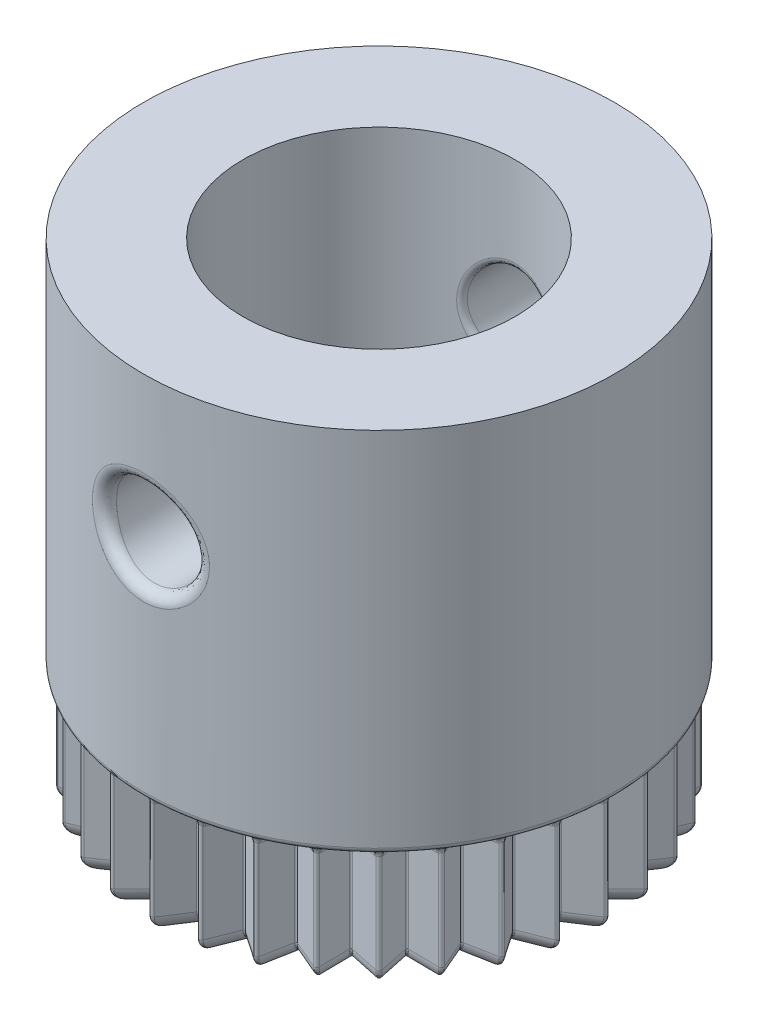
SolidWorks part; units mm, degrees
ref_plane "XY - Vorne" through (0, 0, 0) normal (0, 0, 1) x (1, 0, 0)
ref_plane "XZ - Oben" through (0, 0, 0) normal (0, 1, 0) x (1, 0, 0)
ref_plane "YZ - Rechts" through (0, 0, 0) normal (1, 0, 0) x (0, 0, -1)
sketch "Skizze1" plane through (0, 0, 0) normal (0, 1, 0) x (1, 0, 0)
  circle A0 centre (0, 0) radius 8.45
  dimension "D1" = 16.9
extrude "Aufsatz-Linear austragen1" add sketch "Skizze1" along normal blind 4.5
sketch "Skizze2" plane through (0, 4.5, 0) normal (0, 1, 0) x (1, 0, 0)
  line L0 (0, 0) -> (0, 8.45) construction
  line L1 (-0.0754, 8.3341) -> (-0.7229, 7.3395)
  line L2 (0.0754, 8.3341) -> (0.7229, 7.3395)
  line L4 (0.7229, 7.3395) -> (0, 0) construction
  line L66 (1.5519, 8.1887) -> (0.7229, 7.3395)
  line L67 (1.6999, 8.1593) -> (2.1408, 7.0574)
  line L68 (3.1196, 7.7286) -> (2.1408, 7.0574)
  line L69 (3.259, 7.6709) -> (3.4766, 6.5042)
  line L70 (4.5675, 6.9715) -> (3.4766, 6.5042)
  line L71 (4.6929, 6.8877) -> (4.6787, 5.701)
  line L72 (5.8398, 5.9465) -> (4.6787, 5.701)
  line L73 (5.9465, 5.8398) -> (5.701, 4.6787)
  line L74 (6.8877, 4.6929) -> (5.701, 4.6787)
  line L75 (6.9715, 4.5675) -> (6.5042, 3.4766)
  line L76 (7.6709, 3.259) -> (6.5042, 3.4766)
  line L77 (7.7286, 3.1196) -> (7.0574, 2.1408)
  line L78 (8.1593, 1.6999) -> (7.0574, 2.1408)
  line L79 (8.1887, 1.5519) -> (7.3395, 0.7229)
  line L80 (8.3341, 0.0754) -> (7.3395, 0.7229)
  line L81 (8.3341, -0.0754) -> (7.3395, -0.7229)
  line L82 (8.1887, -1.5519) -> (7.3395, -0.7229)
  line L83 (8.1593, -1.6999) -> (7.0574, -2.1408)
  line L84 (7.7286, -3.1196) -> (7.0574, -2.1408)
  line L85 (7.6709, -3.259) -> (6.5042, -3.4766)
  line L86 (6.9715, -4.5675) -> (6.5042, -3.4766)
  line L87 (6.8877, -4.6929) -> (5.701, -4.6787)
  line L88 (5.9465, -5.8398) -> (5.701, -4.6787)
  line L89 (5.8398, -5.9465) -> (4.6787, -5.701)
  line L90 (4.6929, -6.8877) -> (4.6787, -5.701)
  line L91 (4.5675, -6.9715) -> (3.4766, -6.5042)
  line L92 (3.259, -7.6709) -> (3.4766, -6.5042)
  line L93 (3.1196, -7.7286) -> (2.1408, -7.0574)
  line L94 (1.6999, -8.1593) -> (2.1408, -7.0574)
  line L95 (1.5519, -8.1887) -> (0.7229, -7.3395)
  line L96 (0.0754, -8.3341) -> (0.7229, -7.3395)
  line L97 (-0.0754, -8.3341) -> (-0.7229, -7.3395)
  line L98 (-1.5519, -8.1887) -> (-0.7229, -7.3395)
  line L99 (-1.6999, -8.1593) -> (-2.1408, -7.0574)
  line L100 (-3.1196, -7.7286) -> (-2.1408, -7.0574)
  line L101 (-3.259, -7.6709) -> (-3.4766, -6.5042)
  line L102 (-4.5675, -6.9715) -> (-3.4766, -6.5042)
  line L103 (-4.6929, -6.8877) -> (-4.6787, -5.701)
  line L104 (-5.8398, -5.9465) -> (-4.6787, -5.701)
  line L105 (-5.9465, -5.8398) -> (-5.701, -4.6787)
  line L106 (-6.8877, -4.6929) -> (-5.701, -4.6787)
  line L107 (-6.9715, -4.5675) -> (-6.5042, -3.4766)
  line L108 (-7.6709, -3.259) -> (-6.5042, -3.4766)
  line L109 (-7.7286, -3.1196) -> (-7.0574, -2.1408)
  line L110 (-8.1593, -1.6999) -> (-7.0574, -2.1408)
  line L111 (-8.1887, -1.5519) -> (-7.3395, -0.7229)
  line L112 (-8.3341, -0.0754) -> (-7.3395, -0.7229)
  line L113 (-8.3341, 0.0754) -> (-7.3395, 0.7229)
  line L114 (-8.1887, 1.5519) -> (-7.3395, 0.7229)
  line L115 (-8.1593, 1.6999) -> (-7.0574, 2.1408)
  line L116 (-7.7286, 3.1196) -> (-7.0574, 2.1408)
  line L117 (-7.6709, 3.259) -> (-6.5042, 3.4766)
  line L118 (-6.9715, 4.5675) -> (-6.5042, 3.4766)
  line L119 (-6.8877, 4.6929) -> (-5.701, 4.6787)
  line L120 (-5.9465, 5.8398) -> (-5.701, 4.6787)
  line L121 (-5.8398, 5.9465) -> (-4.6787, 5.701)
  line L122 (-4.6929, 6.8877) -> (-4.6787, 5.701)
  line L123 (-4.5675, 6.9715) -> (-3.4766, 6.5042)
  line L124 (-3.259, 7.6709) -> (-3.4766, 6.5042)
  line L125 (-3.1196, 7.7286) -> (-2.1408, 7.0574)
  line L126 (-1.6999, 8.1593) -> (-2.1408, 7.0574)
  line L127 (-1.5519, 8.1887) -> (-0.7229, 7.3395)
  circle A0 centre (0, 0) radius 7.375 construction
  circle A1 centre (0, 0) radius 8.45 construction
  arc A2 (0.0754, 8.3341) -> (-0.0754, 8.3341) centre (0, 8.285) ccw
  arc A3 (1.6999, 8.1593) -> (1.5519, 8.1887) centre (1.6163, 8.1258) ccw
  arc A4 (3.259, 7.6709) -> (3.1196, 7.7286) centre (3.1705, 7.6544) ccw
  arc A5 (4.6929, 6.8877) -> (4.5675, 6.9715) centre (4.6029, 6.8887) ccw
  arc A6 (5.9465, 5.8398) -> (5.8398, 5.9465) centre (5.8584, 5.8584) ccw
  arc A7 (6.9715, 4.5675) -> (6.8877, 4.6929) centre (6.8887, 4.6029) ccw
  arc A8 (7.7286, 3.1196) -> (7.6709, 3.259) centre (7.6544, 3.1705) ccw
  arc A9 (8.1887, 1.5519) -> (8.1593, 1.6999) centre (8.1258, 1.6163) ccw
  arc A10 (8.3341, -0.0754) -> (8.3341, 0.0754) centre (8.285, 0) ccw
  arc A11 (8.1593, -1.6999) -> (8.1887, -1.5519) centre (8.1258, -1.6163) ccw
  arc A12 (7.6709, -3.259) -> (7.7286, -3.1196) centre (7.6544, -3.1705) ccw
  arc A13 (6.8877, -4.6929) -> (6.9715, -4.5675) centre (6.8887, -4.6029) ccw
  arc A14 (5.8398, -5.9465) -> (5.9465, -5.8398) centre (5.8584, -5.8584) ccw
  arc A15 (4.5675, -6.9715) -> (4.6929, -6.8877) centre (4.6029, -6.8887) ccw
  arc A16 (3.1196, -7.7286) -> (3.259, -7.6709) centre (3.1705, -7.6544) ccw
  arc A17 (1.5519, -8.1887) -> (1.6999, -8.1593) centre (1.6163, -8.1258) ccw
  arc A18 (-0.0754, -8.3341) -> (0.0754, -8.3341) centre (0, -8.285) ccw
  arc A19 (-1.6999, -8.1593) -> (-1.5519, -8.1887) centre (-1.6163, -8.1258) ccw
  arc A20 (-3.259, -7.6709) -> (-3.1196, -7.7286) centre (-3.1705, -7.6544) ccw
  arc A21 (-4.6929, -6.8877) -> (-4.5675, -6.9715) centre (-4.6029, -6.8887) ccw
  arc A22 (-5.9465, -5.8398) -> (-5.8398, -5.9465) centre (-5.8584, -5.8584) ccw
  arc A23 (-6.9715, -4.5675) -> (-6.8877, -4.6929) centre (-6.8887, -4.6029) ccw
  arc A24 (-7.7286, -3.1196) -> (-7.6709, -3.259) centre (-7.6544, -3.1705) ccw
  arc A25 (-8.1887, -1.5519) -> (-8.1593, -1.6999) centre (-8.1258, -1.6163) ccw
  arc A26 (-8.3341, 0.0754) -> (-8.3341, -0.0754) centre (-8.285, 0) ccw
  arc A27 (-8.1593, 1.6999) -> (-8.1887, 1.5519) centre (-8.1258, 1.6163) ccw
  arc A28 (-7.6709, 3.259) -> (-7.7286, 3.1196) centre (-7.6544, 3.1705) ccw
  arc A29 (-6.8877, 4.6929) -> (-6.9715, 4.5675) centre (-6.8887, 4.6029) ccw
  arc A30 (-5.8398, 5.9465) -> (-5.9465, 5.8398) centre (-5.8584, 5.8584) ccw
  arc A31 (-4.5675, 6.9715) -> (-4.6929, 6.8877) centre (-4.6029, 6.8887) ccw
  arc A32 (-3.1196, 7.7286) -> (-3.259, 7.6709) centre (-3.1705, 7.6544) ccw
  arc A33 (-1.5519, 8.1887) -> (-1.6999, 8.1593) centre (-1.6163, 8.1258) ccw
  point P104 (0, 0)
  point P169 (0, 0)
  dimension "D1" = 14.75
  dimension "D4" = 0.09
  dimension "D2" = 5.625
  dimension "D3" = 32
extrude "Schnitt-Linear austragen2" cut sketch "Skizze2" against normal through all flip side to cut
sketch "Skizze3" plane through (0, 4.5, 0) normal (0, 1, 0) x (1, 0, 0)
  circle A0 centre (0, 0) radius 8.65
  dimension "D1" = 17.3
extrude "Aufsatz-Linear austragen2" add sketch "Skizze3" along normal blind 13.5
sketch "Skizze4" plane through (0, 18, 0) normal (0, 1, 0) x (1, 0, 0)
  circle A0 centre (0, 0) radius 5
  circle A1 centre (0, 0) radius 8.65 construction
  dimension "D1" = 10
extrude "Schnitt-Linear austragen3" cut sketch "Skizze4" against normal blind 15
hole_wizard "Ø3.3 (3.3) Durchmesser Bohrung1" positions "3D-Skizze1" profile "Skizze5" hole size "Ø3.3" standard "DIN"
sketch3d "3D-Skizze1"
  line L0 (0, 12.8, 8.65) -> (0, 18, 8.65) construction
  line L2 (0, 18, 8.65) -> (0, 18, 0) construction
  line L3 (0, 18, 0) -> (0, 4.5, 0) construction
  line L4 (0, 3, 0) -> (0, 18, 0) construction
  circle A0 centre (0, 18, 0) radius 8.65 construction
  point P0 (0, 12.8, 8.65)
  point P7 (0, 26.65, 0)
  dimension "D1" = 9.8
sketch "Skizze5" plane through (0, 12.8, 8.65) normal (1, 0, 0) x (0, -1, 0)
  line L0 (0, 0) -> (0, 17.3)
  line L1 (0, 17.3) -> (1.65, 17.3)
  line L2 (1.65, 17.3) -> (1.65, 0)
  line L5 (1.65, 0) -> (0, 0)
  line L11 (0, -6.35) -> (0, 107.95) construction
  dimension "Bohrerdurchmesser" = 3.3
  dimension "Bohrungstiefe" = 17.3
fillet "Verrundung1" radius 0.6 96 edges at (1.9204, 0, -7.6084) (1.6339, 0, -8.2141) (1.1374, 0, -7.7641) (0.3992, 0, -7.8368) (0, 0, -8.375) (-0.3992, 0, -7.8368) (-1.1374, 0, -7.7641) (-1.6339, 0, -8.2141) (-1.9204, 0, -7.6084) (-2.6302, 0, -7.393) (-3.205, 0, -7.7375) (-3.3678, 0, -7.0875) (-4.022, 0, -6.7378) (-4.6529, 0, -6.9636) (-4.6858, 0, -6.2943) (-5.2592, 0, -5.8237) (-5.922, 0, -5.922) (-5.8237, 0, -5.2592) (-6.2943, 0, -4.6858) (-6.9636, 0, -4.6529) (-6.7378, 0, -4.022) (-7.0875, 0, -3.3678) (-7.7375, 0, -3.205) (-7.393, 0, -2.6302) (-7.6084, 0, -1.9204) (-8.2141, 0, -1.6339) (-7.7641, 0, -1.1374) (-7.8368, 0, -0.3992) (-8.375, 0, 0) (-7.8368, 0, 0.3992) (-7.7641, 0, 1.1374) (-8.2141, 0, 1.6339) (-7.6084, 0, 1.9204) (-7.393, 0, 2.6302) (-7.7375, 0, 3.205) (-7.0875, 0, 3.3678) (-6.7378, 0, 4.022) (-6.9636, 0, 4.6529) (-6.2943, 0, 4.6858) (-5.8237, 0, 5.2592) (-5.922, 0, 5.922) (-5.2592, 0, 5.8237) (-4.6858, 0, 6.2943) (-4.6529, 0, 6.9636) (-4.022, 0, 6.7378) (-3.3678, 0, 7.0875) (-3.205, 0, 7.7375) (-2.6302, 0, 7.393) (-1.9204, 0, 7.6084) (-1.6339, 0, 8.2141) (-1.1374, 0, 7.7641) (-0.3992, 0, 7.8368) (0, 0, 8.375) (0.3992, 0, 7.8368) (1.1374, 0, 7.7641) (1.6339, 0, 8.2141) (1.9204, 0, 7.6084) (2.6302, 0, 7.393) (3.205, 0, 7.7375) (3.3678, 0, 7.0875) (4.022, 0, 6.7378) (4.6529, 0, 6.9636) (4.6858, 0, 6.2943) (5.2592, 0, 5.8237) (5.922, 0, 5.922) (5.8237, 0, 5.2592) (6.2943, 0, 4.6858) (6.9636, 0, 4.6529) (6.7378, 0, 4.022) (7.0875, 0, 3.3678) (7.7375, 0, 3.205) (7.393, 0, 2.6302) (7.6084, 0, 1.9204) (8.2141, 0, 1.6339) (7.7641, 0, 1.1374) (7.8368, 0, 0.3992) (8.375, 0, 0) (7.8368, 0, -0.3992) (7.7641, 0, -1.1374) (8.2141, 0, -1.6339) (7.6084, 0, -1.9204) (7.393, 0, -2.6302) (7.7375, 0, -3.205) (7.0875, 0, -3.3678) (6.7378, 0, -4.022) (6.9636, 0, -4.6529) (6.2943, 0, -4.6858) (5.8237, 0, -5.2592) (5.922, 0, -5.922) (5.2592, 0, -5.8237) (4.6858, 0, -6.2943) (4.6529, 0, -6.9636) (4.022, 0, -6.7378) (3.3678, 0, -7.0875) (3.205, 0, -7.7375) (2.6302, 0, -7.393)
fillet "Verrundung2" radius 0.2 1 edges at (0, 4.5, 8.65)
fillet "Verrundung3" radius 0.05 64 edges at (-4.5003, 0.1757, 5.4836) (-3.344, 0.1757, 6.2562) (-2.0592, 0.1757, 6.7884) (-0.6953, 0.1757, 7.0597) (0.6953, 0.1757, 7.0597) (2.0592, 0.1757, 6.7884) (3.344, 0.1757, 6.2562) (4.5003, 0.1757, 5.4836) (5.4836, 0.1757, 4.5003) (6.2562, 0.1757, 3.344) (6.7884, 0.1757, 2.0592) (7.0597, 0.1757, 0.6953) (7.0597, 0.1757, -0.6953) (6.7884, 0.1757, -2.0592) (6.2562, 0.1757, -3.344) (5.4836, 0.1757, -4.5003) (4.5003, 0.1757, -5.4836) (3.344, 0.1757, -6.2562) (2.0592, 0.1757, -6.7884) (0.6953, 0.1757, -7.0597) (-0.6953, 0.1757, -7.0597) (-2.0592, 0.1757, -6.7884) (-3.344, 0.1757, -6.2562) (-4.5003, 0.1757, -5.4836) (-5.4836, 0.1757, -4.5003) (-6.2562, 0.1757, -3.344) (-6.7884, 0.1757, -2.0592) (-7.0597, 0.1757, -0.6953) (-5.4836, 0.1757, 4.5003) (-6.2562, 0.1757, 3.344) (-6.7884, 0.1757, 2.0592) (-7.0597, 0.1757, 0.6953) (-4.6787, 2.55, 5.701) (-3.4766, 2.55, 6.5042) (-2.1408, 2.55, 7.0574) (-0.7229, 2.55, 7.3395) (0.7229, 2.55, 7.3395) (2.1408, 2.55, 7.0574) (3.4766, 2.55, 6.5042) (4.6787, 2.55, 5.701) (5.701, 2.55, 4.6787) (6.5042, 2.55, 3.4766) (7.0574, 2.55, 2.1408) (7.3395, 2.55, 0.7229) (7.3395, 2.55, -0.7229) (7.0574, 2.55, -2.1408) (6.5042, 2.55, -3.4766) (5.701, 2.55, -4.6787) (4.6787, 2.55, -5.701) (3.4766, 2.55, -6.5042) (2.1408, 2.55, -7.0574) (0.7229, 2.55, -7.3395) (-0.7229, 2.55, -7.3395) (-2.1408, 2.55, -7.0574) (-3.4766, 2.55, -6.5042) (-4.6787, 2.55, -5.701) (-5.701, 2.55, -4.6787) (-6.5042, 2.55, -3.4766) (-7.0574, 2.55, -2.1408) (-7.3395, 2.55, -0.7229) (-5.701, 2.55, 4.6787) (-6.5042, 2.55, 3.4766) (-7.0574, 2.55, 2.1408) (-7.3395, 2.55, 0.7229)
fillet "Verrundung4" radius 0.3 115 edges at (-5.922, 4.5, 5.922) (-5.8302, 4.5, 5.2898) (-5.7241, 4.5, 4.6977) (-6.3255, 4.5, 4.6862) (-6.9636, 4.5, 4.6529) (-6.7501, 4.5, 4.0507) (-6.5306, 4.5, 3.4907) (-7.1182, 4.5, 3.3621) (-7.4107, 4.5, 2.656) (-7.0861, 4.5, 2.1496) (-7.6373, 4.5, 1.9088) (-8.2141, 4.5, 1.6339) (-7.7864, 4.5, 1.1592) (-7.3693, 4.5, 0.7258) (-7.863, 4.5, 0.3821) (-8.375, 4.5, 0) (-7.863, 4.5, -0.3821) (-7.3693, 4.5, -0.7258) (-7.7864, 4.5, -1.1592) (-8.2141, 4.5, -1.6339) (-7.6373, 4.5, -1.9088) (-7.0861, 4.5, -2.1496) (-7.4107, 4.5, -2.656) (-7.7375, 4.5, -3.205) (-7.1182, 4.5, -3.3621) (-6.5306, 4.5, -3.4907) (-6.7501, 4.5, -4.0507) (-6.9636, 4.5, -4.6529) (-6.3255, 4.5, -4.6862) (-5.7241, 4.5, -4.6977) (-5.8302, 4.5, -5.2898) (-5.922, 4.5, -5.922) (-5.2898, 4.5, -5.8302) (-4.6977, 4.5, -5.7241) (-4.6529, 4.5, -6.9636) (-4.0507, 4.5, -6.7501) (-3.4907, 4.5, -6.5306) (-3.3621, 4.5, -7.1182) (-2.656, 4.5, -7.4107) (-2.1496, 4.5, -7.0861) (-1.9088, 4.5, -7.6373) (-1.6339, 4.5, -8.2141) (-1.1592, 4.5, -7.7864) (-0.7258, 4.5, -7.3693) (-0.3821, 4.5, -7.863) (0.3821, 4.5, -7.863) (0.7258, 4.5, -7.3693) (1.1592, 4.5, -7.7864) (1.6339, 4.5, -8.2141) (1.9088, 4.5, -7.6373) (2.656, 4.5, -7.4107) (3.205, 4.5, -7.7375) (3.3621, 4.5, -7.1182) (3.4907, 4.5, -6.5306) (4.0507, 4.5, -6.7501) (4.6862, 4.5, -6.3255) (4.6977, 4.5, -5.7241) (5.2898, 4.5, -5.8302) (5.922, 4.5, -5.922) (5.8302, 4.5, -5.2898) (5.7241, 4.5, -4.6977) (6.3255, 4.5, -4.6862) (6.9636, 4.5, -4.6529) (6.7501, 4.5, -4.0507) (6.5306, 4.5, -3.4907) (7.1182, 4.5, -3.3621) (7.7375, 4.5, -3.205) (7.4107, 4.5, -2.656) (7.0861, 4.5, -2.1496) (7.6373, 4.5, -1.9088) (8.2141, 4.5, -1.6339) (7.7864, 4.5, -1.1592) (7.3693, 4.5, -0.7258) (7.863, 4.5, -0.3821) (8.375, 4.5, 0) (7.863, 4.5, 0.3821) (7.3693, 4.5, 0.7258) (7.7864, 4.5, 1.1592) (8.2141, 4.5, 1.6339) (7.6373, 4.5, 1.9088) (7.0861, 4.5, 2.1496) (7.4107, 4.5, 2.656) (7.7375, 4.5, 3.205) (7.1182, 4.5, 3.3621) (6.5306, 4.5, 3.4907) (6.7501, 4.5, 4.0507) (6.3255, 4.5, 4.6862) (5.7241, 4.5, 4.6977) (5.8302, 4.5, 5.2898) (5.2898, 4.5, 5.8302) (4.6977, 4.5, 5.7241) (4.6862, 4.5, 6.3255) (4.6529, 4.5, 6.9636) (4.0507, 4.5, 6.7501) (3.3621, 4.5, 7.1182) (3.205, 4.5, 7.7375) (2.656, 4.5, 7.4107) (1.9088, 4.5, 7.6373) (1.6339, 4.5, 8.2141) (1.1592, 4.5, 7.7864) (0.7258, 4.5, 7.3693) (0, 4.5, 8.375) (-0.3821, 4.5, 7.863) (-0.7258, 4.5, 7.3693) (-1.1592, 4.5, 7.7864) (-1.6339, 4.5, 8.2141) (-1.9088, 4.5, 7.6373) (-2.1496, 4.5, 7.0861) (-2.656, 4.5, 7.4107) (-3.205, 4.5, 7.7375) (-3.3621, 4.5, 7.1182) (-4.0507, 4.5, 6.7501) (-4.6529, 4.5, 6.9636) (-4.6862, 4.5, 6.3255) (-5.2898, 4.5, 5.8302)
fillet "Verrundung5" radius 0.25 2 edges at (-0.2823, 14.4257, 4.992) (-1.6254, 13.0838, -4.7284)
fillet "Verrundung6" radius 0.4 2 edges at (0.3461, 11.1867, -8.6431) (-1.6133, 13.1462, 8.4982)
